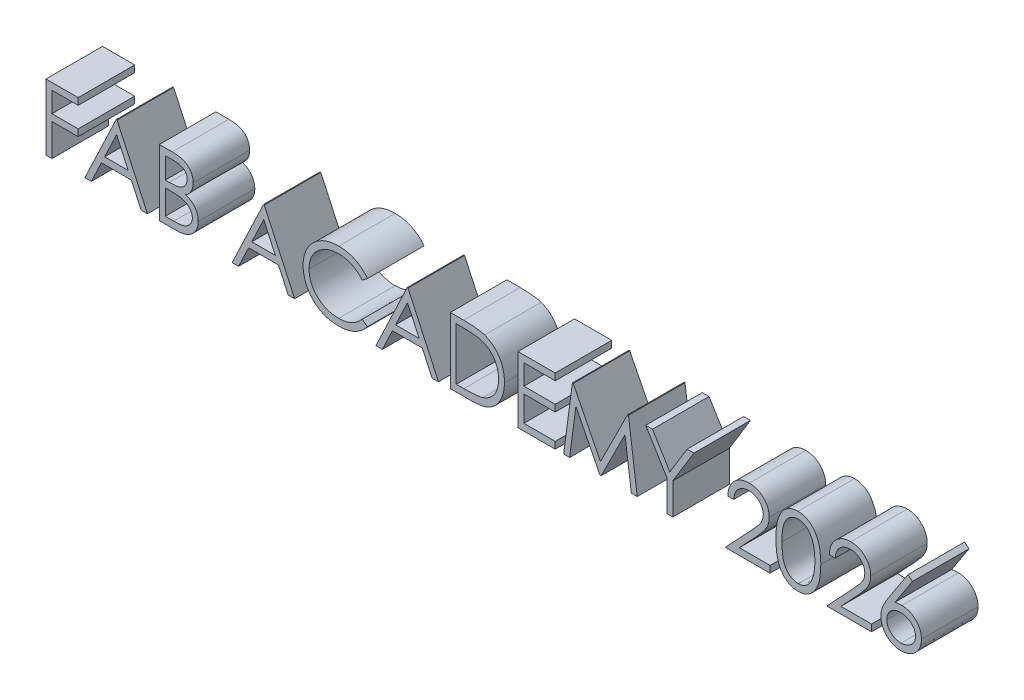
SolidWorks part; units mm, degrees
ref_plane "Alzado" through (0, 0, 0) normal (0, 0, 1) x (1, 0, 0)
ref_plane "Planta" through (0, 0, 0) normal (0, 1, 0) x (1, 0, 0)
ref_plane "Vista lateral" through (0, 0, 0) normal (1, 0, 0) x (0, 0, -1)
sketch "Croquis1" plane through (0, 0, 0) normal (0, 0, 1) x (1, 0, 0)
  text T0 "FAB ACADEMY 2026"
extrude "Saliente-Extruir1" add sketch "Croquis1" along normal blind 3
